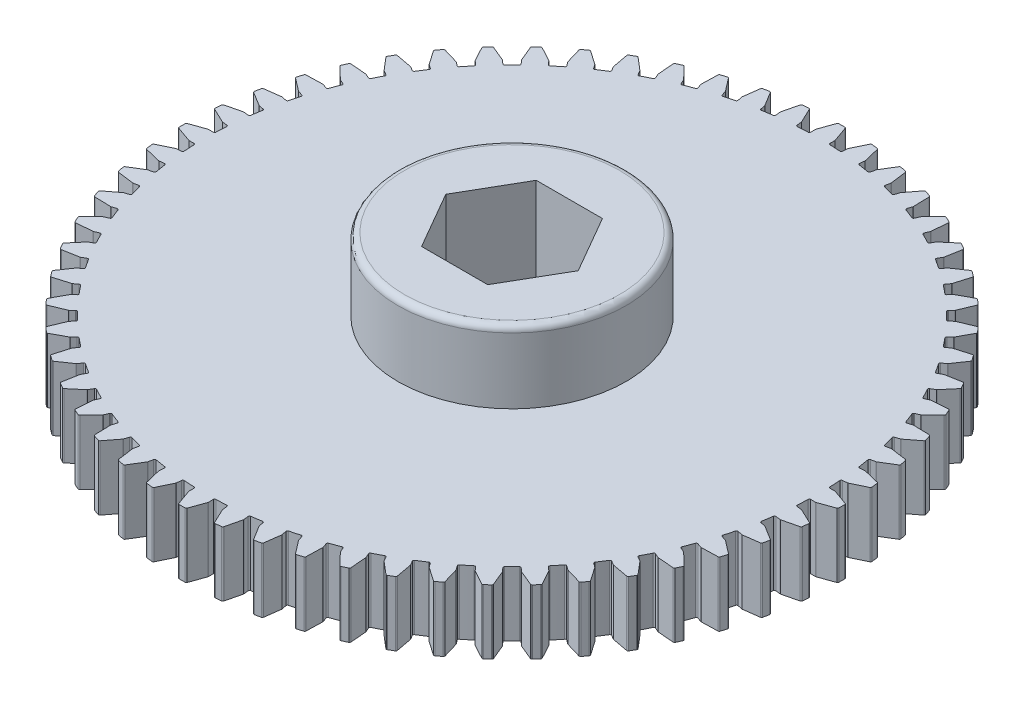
SolidWorks part; units mm, degrees
ref_plane "Front" through (0, 0, 0) normal (0, 0, 1) x (1, 0, 0)
ref_plane "Top" through (0, 0, 0) normal (0, 1, 0) x (1, 0, 0)
ref_plane "Right" through (0, 0, 0) normal (1, 0, 0) x (0, 0, -1)
sketch "Sketch1" plane through (0, 0, 0) normal (0, 1, 0) x (1, 0, 0)
  circle A0 centre (0, 0) radius 30.2895
  dimension "D1" = 60.579
extrude "Extrude1" add sketch "Sketch1" along normal blind 6.35
sketch "Sketch2" plane through (0, 6.35, 0) normal (0, 1, 0) x (-1, 0, 0)
  circle A0 centre (0, 0) radius 11.2395
  dimension "D1" = 22.479
extrude "Extrude2" add sketch "Sketch2" along normal blind 7.112
sketch "Sketch3" plane through (0, 0, 0) normal (0, -1, 0) x (1, 0, 0)
  circle A0 centre (0, 0) radius 27.178
  circle A1 centre (0, 0) radius 6.985
  dimension "D1" = 13.97
  dimension "D2" = 54.356
extrude "Cut-Extrude1" cut sketch "Sketch3" against normal blind 1.651
sketch "Sketch5" plane through (0, 13.462, 0) normal (0, 1, 0) x (-1, 0, 0)
  line L1 (6.5258, 0) -> (3.2629, 5.6515)
  line L2 (3.2629, 5.6515) -> (-3.2629, 5.6515)
  line L3 (-3.2629, 5.6515) -> (-6.5258, 0)
  line L4 (-6.5258, 0) -> (-3.2629, -5.6515)
  line L5 (-3.2629, -5.6515) -> (3.2629, -5.6515)
  line L6 (3.2629, -5.6515) -> (6.5258, 0)
  circle A0 centre (0, 0) radius 5.6515 construction
  dimension "D1" = 11.303
extrude "Cut-Extrude3" cut sketch "Sketch5" against normal through all
fillet "Fillet1" radius 0.635 1 edges at (0, 13.462, 11.2395)
sketch "Sketch6" plane through (0, 6.35, 0) normal (0, 1, 0) x (-1, 0, 0)
  line L0 (0.9525, -30.8969) -> (0.381, -32.5098)
  line L1 (0.9525, -29.4856) -> (0, -29.4856)
  line L2 (0.9525, -30.8969) -> (0.9525, -29.4856)
  line L3 (0, -29.4856) -> (-0.9525, -29.4856)
  line L4 (-0.9525, -30.8969) -> (-0.9525, -29.4856)
  line L5 (-0.9525, -30.8969) -> (-0.381, -32.5098)
  arc A0 (-0.381, -32.5098) -> (0.381, -32.5098) centre (0, 0) ccw
  dimension "D1" = 32.512
  dimension "D4" = 0.762
  dimension "D2" = 1.6129
  dimension "D3" = 1.905
extrude "Extrude3" add sketch "Sketch6" against normal up to surface
fillet "Fillet2" radius 0.127 6 edges at (0.9525, 3.175, -30.8969) (-0.9525, 3.175, -30.2745) (-0.9525, 3.175, -30.8969) (-0.381, 3.175, -32.5098) (0.381, 3.175, -32.5098) (0.9525, 3.175, -30.2745)
pattern_circular "CirPattern1" count 60 over 360 about axis through (0, 0, 0) along (0, 1, 0) of "Extrude3", "Fillet2"
chamfer "Chamfer1" distance 1.651 angle 30 1 edges at (0, 0, -27.178)
